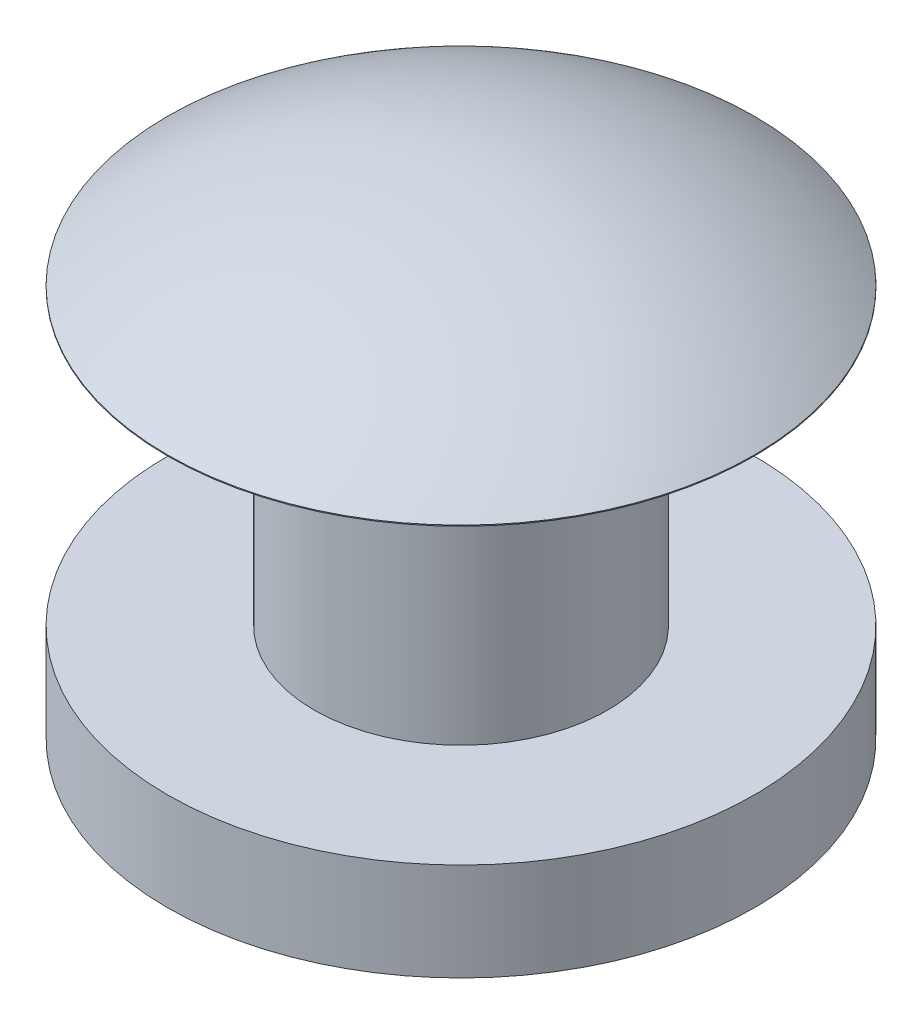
SolidWorks part; units mm, degrees
ref_plane "Plan de face" through (0, 0, 0) normal (0, 0, 1) x (1, 0, 0)
ref_plane "Plan de dessus" through (0, 0, 0) normal (0, 1, 0) x (1, 0, 0)
ref_plane "Plan de droite" through (0, 0, 0) normal (1, 0, 0) x (0, 0, -1)
sketch "Esquisse1" plane through (0, 0, 0) normal (0, 0, 1) x (1, 0, 0)
  line L0 (-1.5, 4) -> (-1.5, 1)
  line L1 (-1.5, 1) -> (-3, 1)
  line L2 (-3, 1) -> (-3, 0)
  line L3 (-3, 0) -> (0, 0)
  line L4 (-1.5, 4) -> (-3, 4)
  line L5 (-3, 4) -> (-3, 4.01)
  line L6 (0, 12.2589) -> (0, -5.3525) construction
  line L7 (0, 0) -> (0, 5.008)
  arc A0 (-3, 4.01) -> (0, 5.008) centre (0, 0) cw
  dimension "D1" = 1.5
  dimension "D2" = 3
  dimension "D3" = 1
  dimension "D4" = 3
  dimension "D5" = 0.01
  dimension "D6" = 3
revolve "Révolution1" add sketch "Esquisse1" angle 360 about L6
